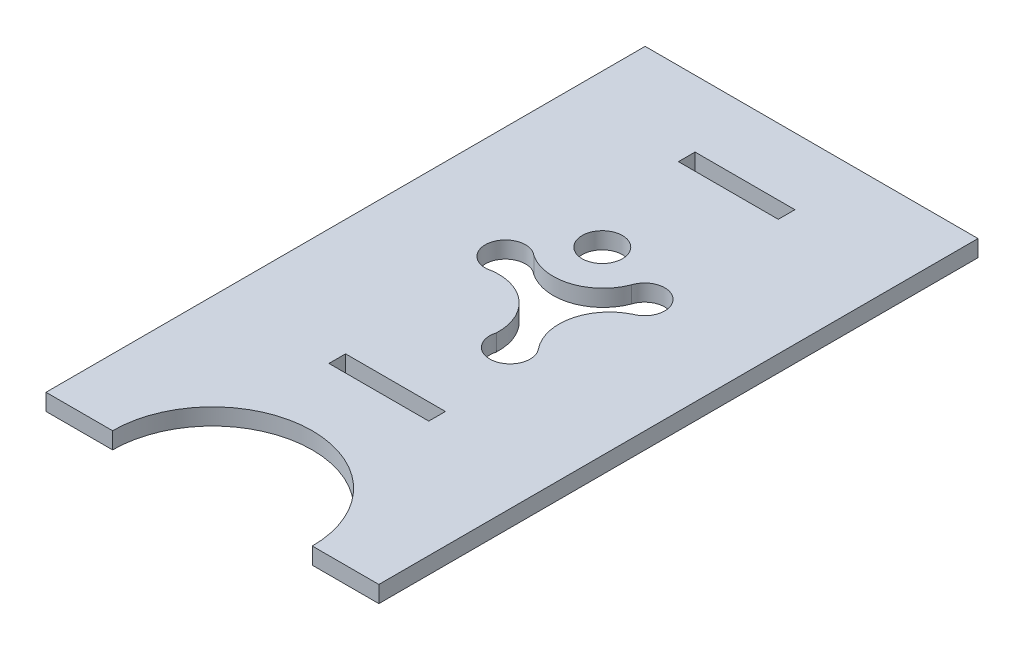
SolidWorks part; units mm, degrees
ref_plane "Alzado" through (0, 0, 0) normal (0, 0, 1) x (1, 0, 0)
ref_plane "Planta" through (0, 0, 0) normal (0, 1, 0) x (1, 0, 0)
ref_plane "Vista lateral" through (0, 0, 0) normal (1, 0, 0) x (0, 0, -1)
sketch "Croquis1" plane through (0, 0, 0) normal (0, 1, 0) x (1, 0, 0)
  line L1 (365.5164, -130.9064) -> (385.5164, -130.9064)
  line L8 (320.5164, -80.9064) -> (350.5164, -80.9064)
  line L9 (285.5164, -130.9064) -> (305.5164, -130.9064)
  line L10 (285.5164, -130.9064) -> (285.5164, 49.0936)
  line L11 (285.5164, 49.0936) -> (385.5164, 49.0936)
  line L12 (385.5164, -130.9064) -> (385.5164, 49.0936)
  line L13 (350.5164, -80.9064) -> (350.5164, -75.9064)
  line L14 (350.5164, -75.9064) -> (320.5164, -75.9064)
  line L15 (320.5164, -75.9064) -> (320.5164, -80.9064)
  line L17 (320.5164, 24.0936) -> (320.5164, 29.0936)
  line L18 (350.5164, 24.0936) -> (320.5164, 24.0936)
  line L19 (350.5164, 29.0936) -> (350.5164, 24.0936)
  line L20 (320.5164, 29.0936) -> (350.5164, 29.0936)
  arc A0 (365.5164, -130.9064) -> (305.5164, -130.9064) centre (335.5164, -130.9064) ccw
  point P0 (-30.909, -85.6617)
  point P1 (-30.909, 14.3383)
  point P2 (39.8017, 85.049)
  point P3 (210.5124, 14.3383)
  point P4 (139.8017, 85.049)
  point P6 (210.5124, -85.6617)
  point P7 (139.8017, -156.3724)
  point P8 (39.8017, -156.3724)
  point P14 (-35.909, -85.6617)
  point P17 (-35.909, 16.4093)
  point P22 (37.7306, 90.049)
  point P23 (141.8728, 90.049)
  point P24 (214.0479, 17.8738)
  point P25 (214.0479, -89.1973)
  point P26 (141.8728, -161.3724)
  point P27 (37.7306, -161.3724)
  point P28 (-34.4445, -89.1973)
  point P29 (215.5124, 14.3383)
  point P30 (215.5124, -85.6617)
  point P36 (-30.909, -20.6617)
  point P37 (210.5124, -20.6617)
  point P38 (210.5124, -50.6617)
  point P39 (-30.909, -50.6617)
  point P40 (164.5504, -131.6237)
  point P41 (-6.1602, 39.087)
  point P42 (15.053, 60.3002)
  point P43 (185.7636, -110.4105)
  dimension "D6" = 20
  dimension "D7" = 100
  dimension "D8" = 5
  dimension "D14" = 100
  dimension "D15" = 5
  dimension "D16" = 180
  dimension "D17" = 35
  dimension "D18" = 35
extrude "Saliente-Extruir1" add sketch "Croquis1" along normal blind 5
sketch "Croquis2" plane through (0, 5, 0) normal (0, 1, 0) x (1, 0, 0)
  line L0 (252.8497, 553.3474) -> (1095.5164, 553.3474) construction
  circle A0 centre (331.3124, -9.5771) radius 6.0506
  arc A1 (353.3408, -22.4737) -> (345.493, -15.0392) centre (351.2633, -16.8074) ccw
  arc A2 (323.1502, -21.9914) -> (320.9779, -32.309) centre (319.1634, -26.5395) ccw
  arc A3 (337.7046, -47.8182) -> (348.1879, -45.6266) centre (343.5336, -49.5317) ccw
  arc A4 (353.3408, -22.4737) -> (348.1879, -45.6266) centre (359.9973, -36.105) ccw
  arc A5 (320.9779, -32.309) -> (337.7046, -47.8182) centre (322.7862, -47.1332) cw
  arc A6 (323.1502, -21.9914) -> (345.493, -15.0392) centre (331.5409, -9.5789) ccw
extrude "Cortar-Extruir1" cut sketch "Croquis2" against normal blind 5
